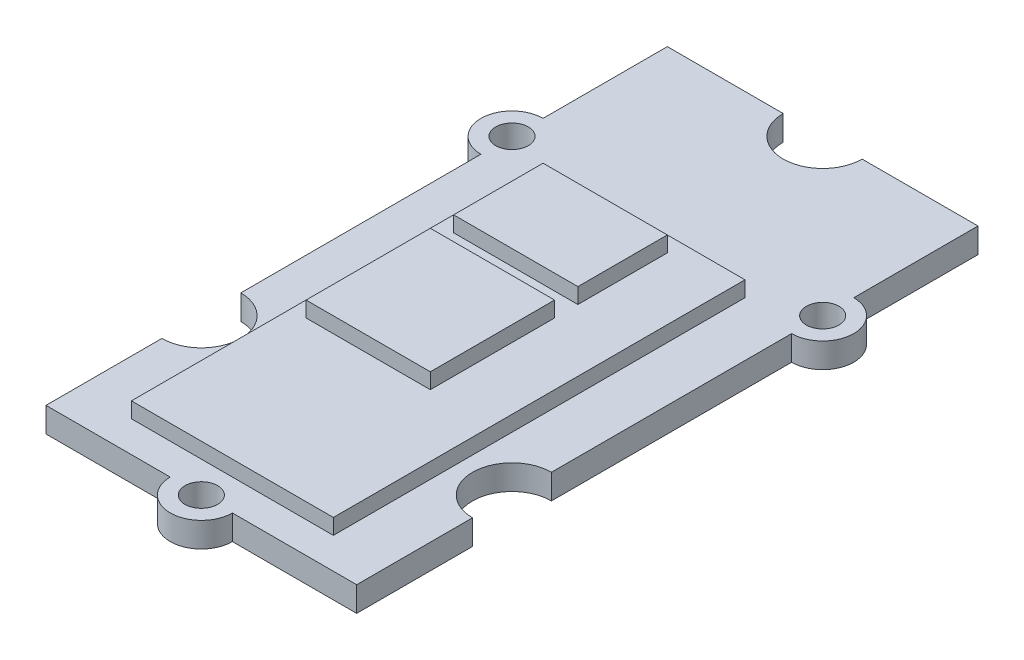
SolidWorks part; units mm, degrees
ref_plane "Plan de face" through (0, 0, 0) normal (0, 0, 1) x (1, 0, 0)
ref_plane "Plan de dessus" through (0, 0, 0) normal (0, 1, 0) x (1, 0, 0)
ref_plane "Plan de droite" through (0, 0, 0) normal (1, 0, 0) x (0, 0, -1)
sketch "Esquisse1" plane through (0, 0, 0) normal (0, 1, 0) x (1, 0, 0)
  line L0 (0, -32.3871) -> (0, 19.0735) construction
  line L1 (-6.5549, 0) -> (20.5339, 0) construction
  line L2 (10, -35.1222) -> (10, 26.0418) construction
  line L3 (-10, -35.1222) -> (-10, 26.0418) construction
  line L4 (30.6769, 10) -> (-12.9387, 10) construction
  line L5 (30.6769, -20) -> (-12.9387, -20) construction
  line L6 (10, -2) -> (10, -17.46)
  line L7 (-10, 10) -> (-2.54, 10)
  line L8 (-10, 10) -> (-10, 2)
  line L9 (30.6769, -30) -> (-12.9387, -30) construction
  line L10 (10, 10) -> (10, 2)
  line L11 (-10, -2) -> (-10, -17.46)
  line L12 (2.54, 10) -> (10, 10)
  line L13 (-10, -30) -> (-2, -30)
  line L14 (10, -22.54) -> (10, -30)
  line L15 (-10, -22.54) -> (-10, -30)
  line L16 (2, -30) -> (10, -30)
  circle A0 centre (10, 0) radius 1.05
  arc A1 (10, -2) -> (10, 2) centre (10, 0) ccw
  circle A2 centre (-10, 0) radius 1.05
  arc A3 (-10, -2) -> (-10, 2) centre (-10, 0) cw
  arc A4 (-2.54, 10) -> (2.54, 10) centre (0, 10) ccw
  arc A5 (10, -17.46) -> (10, -22.54) centre (10, -20) ccw
  arc A6 (-10, -17.46) -> (-10, -22.54) centre (-10, -20) cw
  circle A7 centre (0, -30) radius 1.05
  arc A8 (-2, -30) -> (2, -30) centre (0, -30) ccw
  dimension "D4" = 10
  dimension "D1" = 10
  dimension "D2" = 10
  dimension "D3" = 20
extrude "Boss.-Extru.1" add sketch "Esquisse1" along normal blind 1.6
sketch "Esquisse2" plane through (0, 1.6, 0) normal (0, 1, 0) x (1, 0, 0)
  line L0 (12.389, -28) -> (-13.0368, -28) construction
  line L1 (0, -34.7524) -> (0, 4.3311) construction
  line L2 (2, -30) -> (10, -30) construction
  line L3 (-6.5, -1.5) -> (6.5, -1.5)
  line L4 (-6.5, -1.5) -> (-6.5, -28)
  line L5 (-6.5, -28) -> (6.5, -28)
  line L6 (6.5, -1.5) -> (6.5, -28)
  line L7 (-6.5, -1.5) -> (6.5, -28) construction
  line L8 (-6.5, -28) -> (6.5, -1.5) construction
  point P6 (0, -14.75)
  dimension "D1" = 2
extrude "Boss.-Extru.2" add sketch "Esquisse2" along normal blind 1
sketch "Esquisse3" plane through (0, 2.6, 0) normal (0, 1, 0) x (1, 0, 0)
  line L0 (-5.5, 1.362) -> (-5.5, -13.6991) construction
  line L1 (-8.1244, -2.5) -> (7.6925, -2.5) construction
  line L2 (6.5, -1.5) -> (-6.5, -1.5) construction
  line L3 (-6.5, -1.5) -> (-6.5, -28) construction
  line L5 (-5.5, -2.5) -> (2.5, -2.5)
  line L6 (-5.5, -2.5) -> (-5.5, -8.2584)
  line L7 (-5.5, -8.2584) -> (2.5, -8.2584)
  line L8 (2.5, -2.5) -> (2.5, -8.2584)
  line L9 (-5.5, -9.7584) -> (2.5, -9.7584)
  line L10 (-5.5, -9.7584) -> (-5.5, -17.7584)
  line L11 (-5.5, -17.7584) -> (2.5, -17.7584)
  line L12 (2.5, -9.7584) -> (2.5, -17.7584)
  dimension "D1" = 1
  dimension "D2" = 1
  dimension "D3" = 1.5
extrude "Boss.-Extru.3" add sketch "Esquisse3" along normal blind 1
